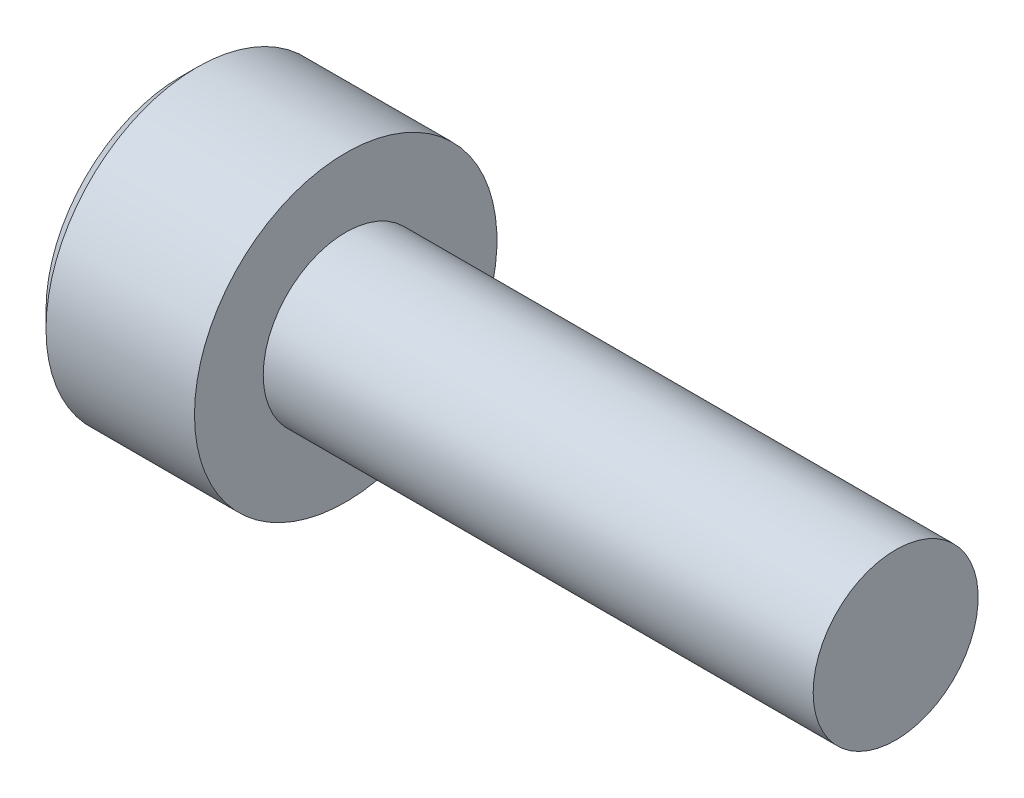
SolidWorks part; units mm, degrees
ref_plane "Front Plane" through (0, 0, 0) normal (0, 0, 1) x (1, 0, 0)
ref_plane "Top Plane" through (0, 0, 0) normal (0, 1, 0) x (1, 0, 0)
ref_plane "Right Plane" through (0, 0, 0) normal (1, 0, 0) x (0, 0, -1)
sketch "Sketch1" plane through (0, 0, 0) normal (0, 0, 1) x (1, 0, 0)
  line L2 (-3, 0) -> (10, 0)
  line L3 (10, 0) -> (10, 1.5)
  line L4 (10, 1.5) -> (0, 1.5)
  line L5 (0, 1.5) -> (0, 2.75)
  line L6 (0, 2.75) -> (-3, 2.75)
  line L7 (-3, 2.75) -> (-3, 0)
  line L8 (-3, 0) -> (10, 0) construction
  line L9 (0, 0) -> (0, 2.75) construction
  dimension "E" = 3
  dimension "L" = 10
  dimension "A" = 5.5
  dimension "M" = 3
revolve "Revolve1" add sketch "Sketch1" about L8
chamfer "Chamfer1" distance 0.3 1 edges at (-3, 0, 2.75)
sketch "Sketch2" plane through (0, 0, 0) normal (0, 0, 1) x (1, 0, 0)
  line L0 (-0.9489, 0) -> (-1.7, 1.25)
  line L1 (-3, 0) -> (10, 0) construction
  line L2 (-1.7, 1.25) -> (-3, 1.25)
  line L3 (-3, 2.75) -> (-3, 0) construction
  line L4 (-3, 1.25) -> (-3, 0)
  line L5 (-3, 0) -> (-0.9489, 0) construction
  line L6 (-0.9489, 0) -> (-3, 0)
  dimension "FIX_3" = 59
revolve "Cut-Revolve1" cut sketch "Sketch2" about L5
sketch "Sketch3" plane through (-3, 0, 0) normal (-1, 0, 0) x (0, 0, 1)
  line L0 (0, -1.4434) -> (0, 1.4434) construction
  line L1 (0, -1.4434) -> (1.25, -0.7217)
  line L2 (1.25, -0.7217) -> (1.25, 0.7217)
  line L3 (1.25, 0.7217) -> (0, 1.4434)
  line L4 (0, 1.4434) -> (-1.25, 0.7217)
  line L5 (-1.25, 0.7217) -> (-1.25, -0.7217)
  line L6 (-1.25, -0.7217) -> (0, -1.4434)
  line L7 (-1.25, 0) -> (1.25, 0) construction
  circle A0 centre (0, 0) radius 1.25 construction
extrude "Cut-Extrude1" cut sketch "Sketch3" against normal blind 1.3
